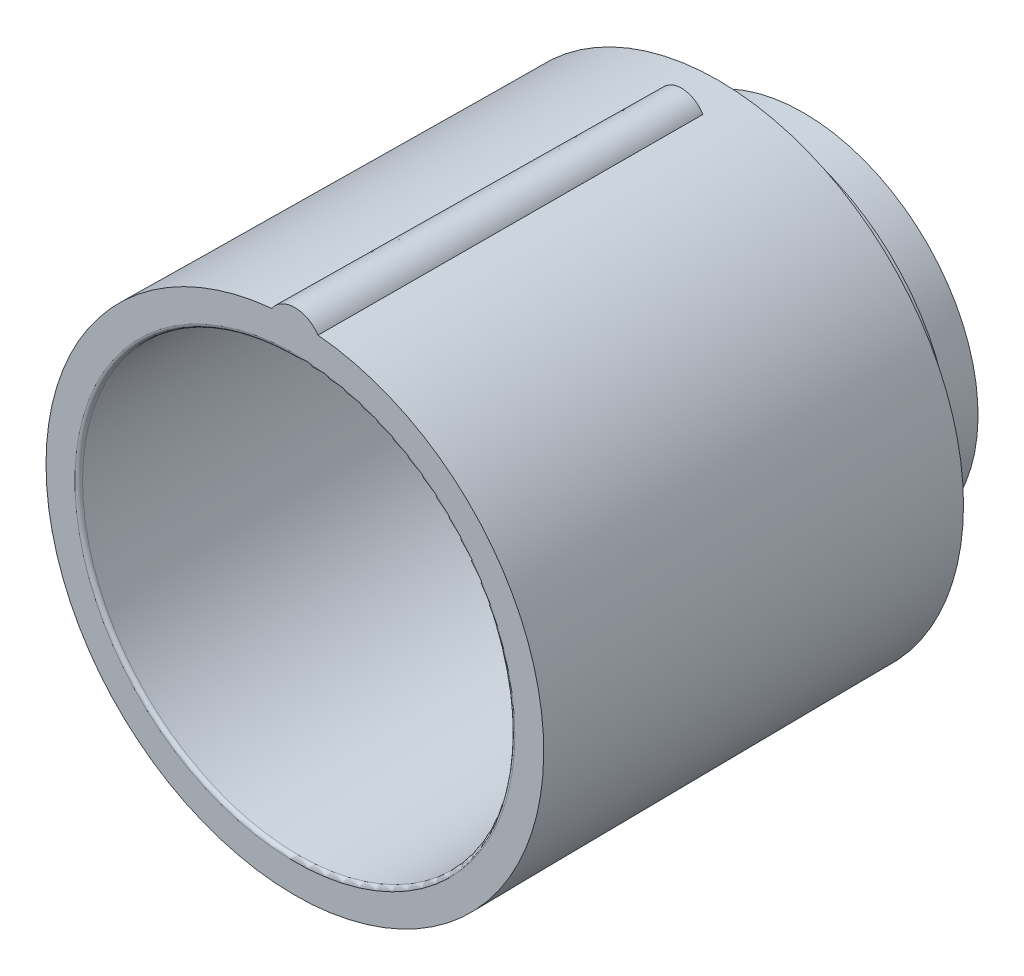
SolidWorks part; units mm, degrees
ref_plane "Plan de face" through (0, 0, 0) normal (0, 0, 1) x (1, 0, 0)
ref_plane "Plan de dessus" through (0, 0, 0) normal (0, 1, 0) x (1, 0, 0)
ref_plane "Plan de droite" through (0, 0, 0) normal (1, 0, 0) x (0, 0, -1)
sketch "Esquisse1" plane through (0, 0, 0) normal (0, 0, 1) x (1, 0, 0)
  circle A0 centre (0, 0) radius 12.67
  dimension "D1" = 25.34
extrude "Extrusion1" add sketch "Esquisse1" along normal blind 3
sketch "Esquisse2" plane through (0, 0, 0) normal (0, 0, -1) x (-1, 0, 0)
  circle A0 centre (0, 0) radius 8
extrude "Extrusion2" add sketch "Esquisse2" along normal blind 10
sketch "Esquisse3" plane through (0, 0, 0) normal (0, 0, -1) x (-1, 0, 0)
  circle A0 centre (0, 0) radius 12.75
  circle A1 centre (0, 0) radius 9.06
  dimension "D1" = 18.12
  dimension "D2" = 25.5
extrude "Enlèv. mat.-Extru.1" cut sketch "Esquisse3" against normal blind 1 draft 0.5
sketch "Esquisse4" plane through (0, 0, 3) normal (0, 0, 1) x (1, 0, 0)
  circle A0 centre (0, 0) radius 12.67 construction
  circle A1 centre (0, 0) radius 12.67
  circle A2 centre (0, 0) radius 10.89
  dimension "D1" = 21.78
extrude "Extrusion3" add sketch "Esquisse4" along normal blind 19.9
sketch "Esquisse20" plane through (0, 0, 22.9) normal (0, 0, 1) x (1, 0, 0)
  line L0 (0, 0) -> (0, 13.6693) construction
  line L1 (-1.3702, 11.5256) -> (1.3702, 11.5256)
  arc A0 (1.3702, 11.5256) -> (-1.3702, 11.5256) centre (0, 12) ccw
  dimension "D1" = 12
draft "Dépouille1" type of draft neutral plane draft angle 0.5 faces to draft 1 parameters "D1"=0.5
draft "Dépouille2" type of draft neutral plane draft angle 0.72 faces to draft 1 parameters "D1"=0.72
sketch "Esquisse19" plane through (0, 0, 0) normal (0, 0, -1) x (-1, 0, 0)
  circle A1 centre (0, 0) radius 9.06
  circle A2 centre (0, 0) radius 9.06
  circle A4 centre (0, 0) radius 7.5
  circle A5 centre (0, 0) radius 7.5
  dimension "D1" = 0
  dimension "D2" = 0.5
extrude "Extrusion7" add sketch "Esquisse19" along normal blind 3.4 draft 0.5
sketch "Esquisse14" plane through (0, 0, -10) normal (0, 0, -1) x (-1, 0, 0)
  line L0 (0, 7.0577) -> (0, -7.7741) construction
  circle A0 centre (0, -2.15) radius 6
  dimension "D1" = 2.15
extrude "Enlèv. mat.-Extru.4" cut sketch "Esquisse14" against normal blind 20
sketch "Esquisse16" plane through (0, 0, 0) normal (1, 0, 0) x (0, 0, -1)
  line L0 (3.4, -9.0303) -> (3.4, 9.0303) construction
  line L1 (3.4, 0) -> (3.4, 8.13)
  line L2 (11.0009, 8.13) -> (3.4, 8.13)
  line L3 (3.4, 0) -> (11.0009, 0)
  line L4 (11.0009, 0) -> (11.0009, 8.13)
  line L5 (-2.0204, 0) -> (11.816, 0) construction
  line L6 (-22.9, 0) -> (-1, 0) construction
  dimension "D1" = 8.13
  dimension "D2" = 7.6009
revolve "Enlèvement de matière-Révolution2" cut sketch "Esquisse16" angle 360 about L5
extrude "Extrusion8" add sketch "Esquisse20" against normal blind 20 draft 0.5
sketch "Esquisse26" plane through (0, 0, 3) normal (0, 0, 1) x (1, 0, 0)
  arc A0 (-1.2001, 12.8138) -> (1.2001, 12.8138) centre (0, 0) ccw construction
  circle A1 centre (0, 0) radius 8.15
  circle A2 centre (0, -2.15) radius 6 construction
extrude "Enlèv. mat.-Extru.8" cut sketch "Esquisse26" against normal blind 4.8
sketch "Esquisse27" plane through (0, 0, 1) normal (0, 0, -1) x (-1, 0, 0)
  circle A2 centre (0, 0) radius 8.5687
  circle A3 centre (0, 0) radius 8.5687
  circle A5 centre (0, 0) radius 10.0687
  circle A6 centre (0, 0) radius 10.0687
  dimension "D1" = 0.5
  dimension "D2" = 1
extrude "Extrusion9" add sketch "Esquisse27" along normal blind 2 draft 0.5
ref_plane "Plan1" through (0, 10.1, 0) normal (0, 1, 0) x (-1, 0, 0)
sketch "Esquisse28" plane through (0, 10.1, 0) normal (0, 1, 0) x (-1, 0, 0)
  line L0 (0, 2.9) -> (0, -6.0421) construction
  line L1 (-1.0988, 2.9) -> (1.0988, 2.9) construction
  line L3 (-9.0303, -3.4) -> (9.0303, -3.4) construction
  circle A0 centre (0, 0) radius 0.8437
  dimension "D1" = 3.4
extrude "Enlèv. mat.-Extru.9" cut sketch "Esquisse28" against normal blind 2.5 draft 0.5
draft "Dépouille3" type of draft neutral plane draft angle 0.5 faces to draft 1 parameters "D1"=0.5
fillet "Congé6" radius 0.2 5 edges at (0, 3.85, -3.4) (8.1919, 0, 3) (10.9277, 0, 3) (6, -2.15, -1.8) (11.1778, 0, 22.9)
fillet "Congé7" radius 0.2
